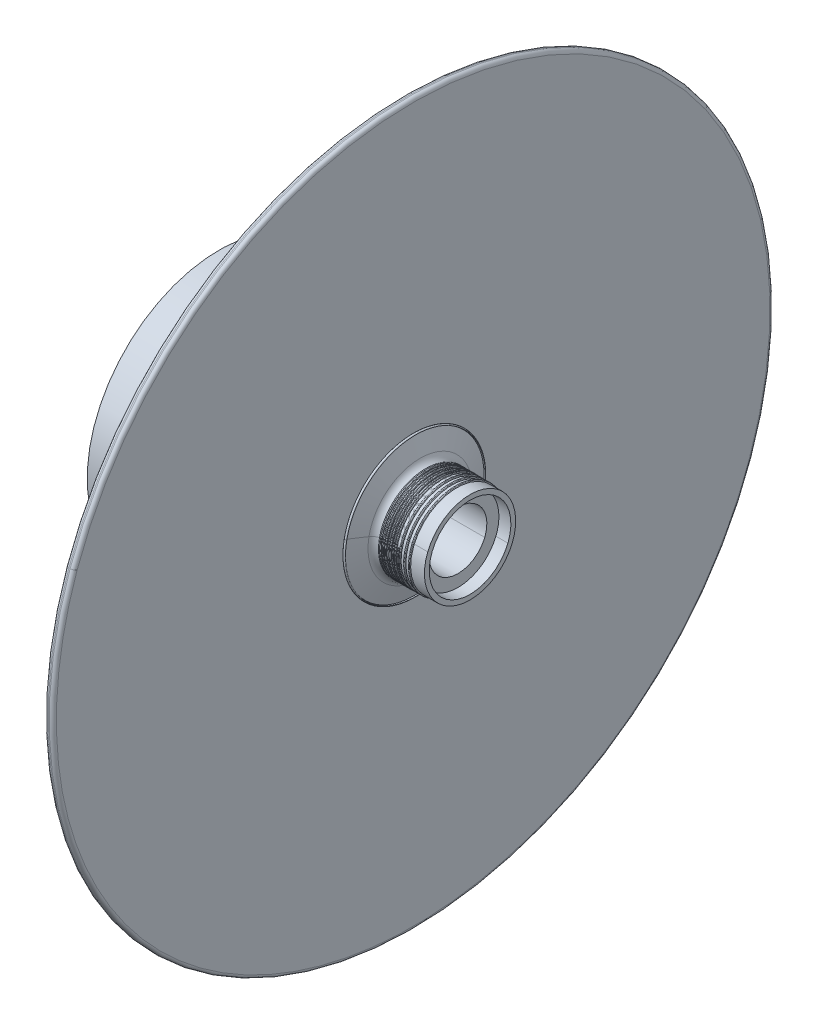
SolidWorks part; units mm, degrees
ref_plane "Alzado" through (0, 0, 0) normal (0, 0, 1) x (1, 0, 0)
ref_plane "Planta" through (0, 0, 0) normal (0, 1, 0) x (1, 0, 0)
ref_plane "Vista lateral" through (0, 0, 0) normal (1, 0, 0) x (0, 0, -1)
imported_body "A1096-35.IGS<1>"
delete or keep bodies "Sólido-Eliminar/Conservar 1" type delete bodies bodies 101
ref_plane "Plano1" through (19.52, 0, 0) normal (1, 0, 0) x (0, 0, -1)
sketch "Croquis2" plane through (19.52, 0, 0) normal (1, 0, 0) x (0, 0, -1)
  circle A0 centre (13.6251, -11.4202) radius 54.991
  dimension "D1" = 109.982
extrude "Saliente-Extruir1" add sketch "Croquis2" against normal blind 29.972
